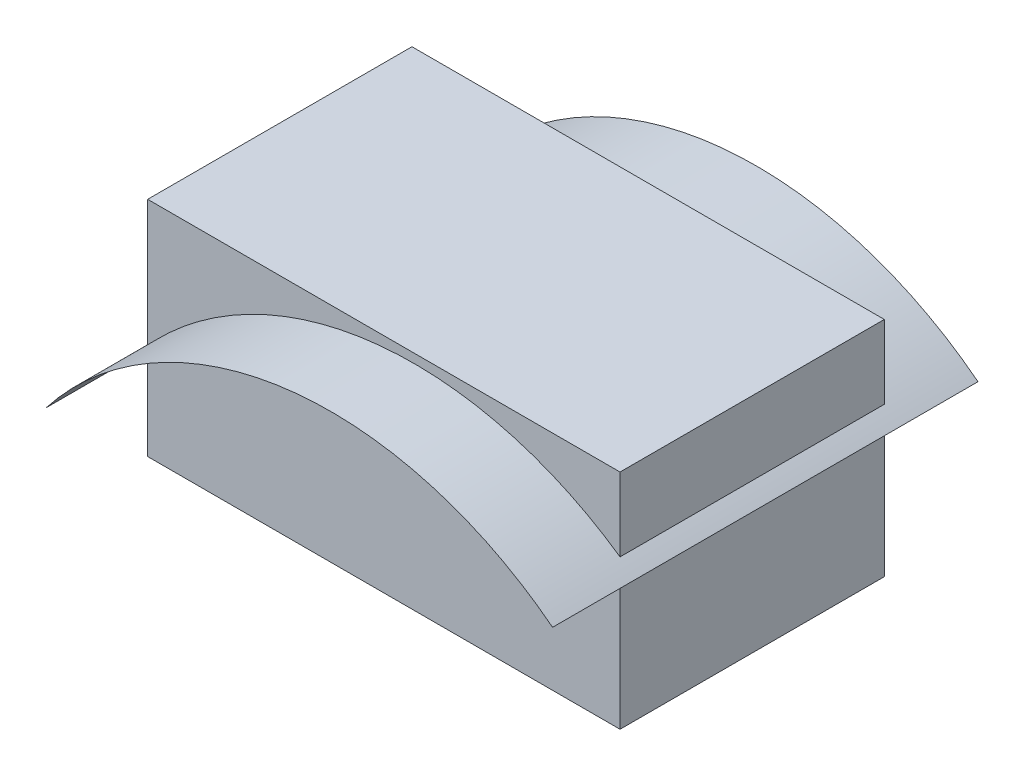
SolidWorks part; units mm, degrees
ref_plane "Front" through (0, 0, 0) normal (0, 0, 1) x (1, 0, 0)
ref_plane "Top" through (0, 0, 0) normal (0, 1, 0) x (1, 0, 0)
ref_plane "Right" through (0, 0, 0) normal (1, 0, 0) x (0, 0, -1)
sketch "Sketch1" plane through (0, 0, 0) normal (0, 0, 1) x (1, 0, 0)
  line L1 (0, 0) -> (109.0296, 0)
  line L2 (0, 0) -> (0, 51.429)
  line L3 (0, 51.429) -> (109.0296, 51.429)
  line L4 (109.0296, 0) -> (109.0296, 51.429)
extrude "Extrude1" add sketch "Sketch1" along normal mid plane 61
sketch "Sketch2" plane through (0, 0, 30.5) normal (0, 0, 1) x (1, 0, 0)
  arc A0 (-4.2733, 17.2004) -> (112.6542, 31.7961) centre (61.4883, -33.9655) cw
surface "Surface-Extrude1" sketch "Sketch2" parameters "D1"=19.1969, "D2"=79
